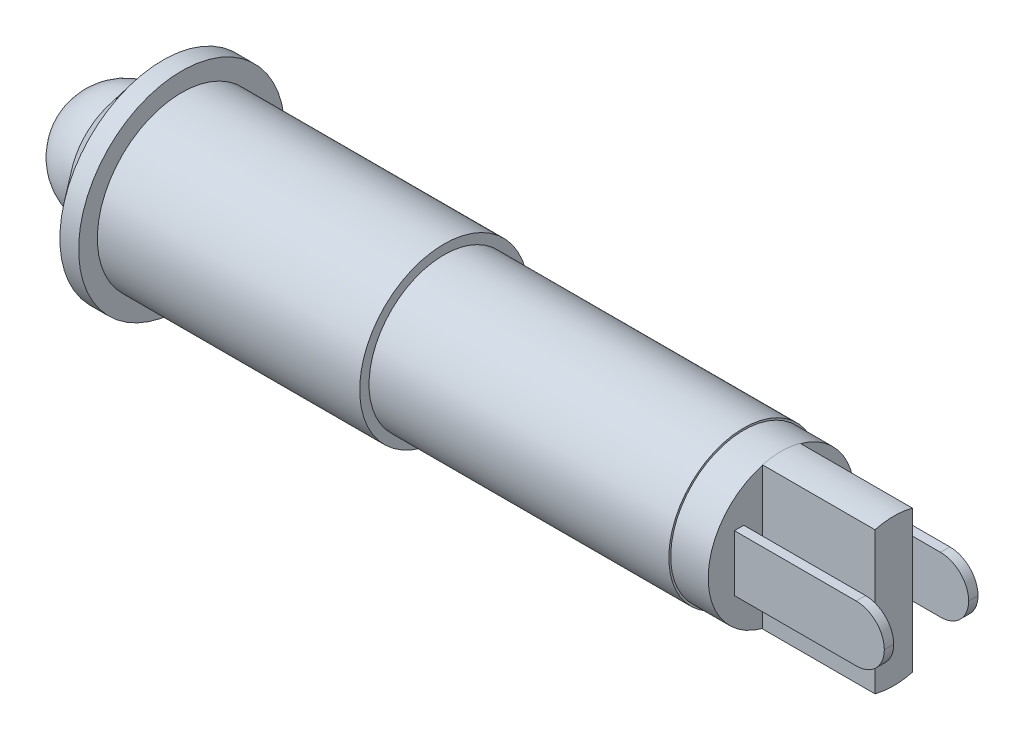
SolidWorks part; units mm, degrees
ref_plane "Plan de face" through (0, 0, 0) normal (0, 0, 1) x (1, 0, 0)
ref_plane "Plan de dessus" through (0, 0, 0) normal (0, 1, 0) x (1, 0, 0)
ref_plane "Plan de droite" through (0, 0, 0) normal (1, 0, 0) x (0, 0, -1)
sketch "Esquisse1" plane through (0, 0, 0) normal (0, 0, 1) x (1, 0, 0)
  line L0 (2, 5.5) -> (0, 3)
  line L2 (2, 5.5) -> (3, 5.5)
  line L3 (3, 5.5) -> (3, 4.5)
  line L4 (3, 4.5) -> (17, 4.5)
  line L5 (17, 4.5) -> (17, 4)
  line L6 (17, 4) -> (33, 4)
  line L7 (33, 4) -> (33, 0)
  line L8 (33, 0) -> (0, 0)
  line L9 (0, 3) -> (0, 0)
  dimension "D1" = 4.5
  dimension "D2" = 4
  dimension "D3" = 14
  dimension "D4" = 16
  dimension "D5" = 1
  dimension "D6" = 3
  dimension "D7" = 3
  dimension "D8" = 5.5
revolve "Révolution1" add sketch "Esquisse1" angle 360 about L8
sketch "Esquisse3" plane through (0, 0, 0) normal (0, 0, 1) x (1, 0, 0)
  line L0 (0, 3) -> (0, -3)
  arc A0 (0, 3) -> (0, -3) centre (0, 0) ccw
  dimension "D1" = 6
revolve "Révolution2" add sketch "Esquisse3" angle 360 about L0
sketch "Esquisse4" plane through (33, 0, 0) normal (1, 0, 0) x (0, 0, -1)
  circle A0 centre (0, 0) radius 3.9
  dimension "D1" = 7.8
extrude "Boss.-Extru.1" add sketch "Esquisse4" along normal blind 2
sketch "Esquisse5" plane through (35, 0, 0) normal (1, 0, 0) x (0, 0, -1)
  line L0 (-1, 3.7927) -> (-1, -3.7927)
  line L1 (1, 3.7927) -> (1, -3.7927)
  arc A0 (1, 3.7927) -> (-1, 3.7927) centre (0, 0) ccw
  arc A1 (-1, -3.7927) -> (1, -3.7927) centre (0, 0) ccw
  dimension "D1" = 1
  dimension "D2" = 1
extrude "Boss.-Extru.2" add sketch "Esquisse5" along normal blind 6
sketch "Esquisse6" plane through (35, 0, 0) normal (1, 0, 0) x (0, 0, -1)
  line L0 (-3.9, 0) -> (3.9, 0) construction
  line L1 (-2.5, 0) -> (-2, 0) construction
  line L2 (-2.5, 1.5) -> (-2, 1.5)
  line L3 (-2.5, 1.5) -> (-2.5, -1.5)
  line L4 (-2.5, -1.5) -> (-2, -1.5)
  line L5 (-2, 1.5) -> (-2, -1.5)
  line L6 (-1, 3.7696) -> (-1, -3.7696) construction
  line L7 (1, -3.7696) -> (1, 3.7696) construction
  line L8 (2, 1.5) -> (2.5, 1.5)
  line L9 (2, 1.5) -> (2, -1.5)
  line L10 (2, -1.5) -> (2.5, -1.5)
  line L11 (2.5, 1.5) -> (2.5, -1.5)
  arc A0 (-1, 3.7696) -> (-1, -3.7696) centre (0, 0) ccw construction
  arc A1 (1, -3.7696) -> (1, 3.7696) centre (0, 0) ccw construction
  dimension "D1" = 3
  dimension "D2" = 1
  dimension "D3" = 0.5
  dimension "D4" = 1
  dimension "D5" = 0.5
extrude "Boss.-Extru.3" add sketch "Esquisse6" along normal blind 8
fillet "Congé1" radius 1.5 4 edges at (43, -1.5, -2.25) (43, 1.5, -2.25) (43, -1.5, 2.25) (43, 1.5, 2.25)
